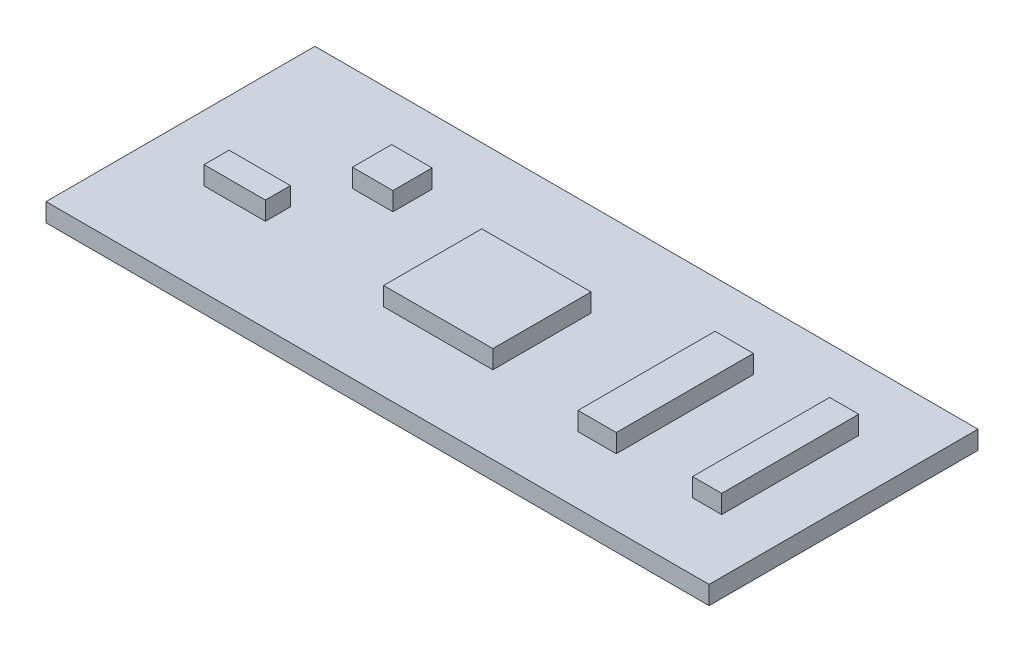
SolidWorks part; units mm, degrees
ref_plane "Front" through (0, 0, 0) normal (0, 0, 1) x (1, 0, 0)
ref_plane "Top" through (0, 0, 0) normal (0, 1, 0) x (1, 0, 0)
ref_plane "Right" through (0, 0, 0) normal (1, 0, 0) x (0, 0, -1)
sketch "Sketch1" plane through (0, 0, 0) normal (0, 0, 1) x (1, 0, 0)
  line L1 (0, 0) -> (54, 0)
  line L2 (0, 0) -> (0, 1.5)
  line L3 (0, 1.5) -> (54, 1.5)
  line L4 (54, 0) -> (54, 1.5)
  dimension "D1" = 54
  dimension "D2" = 1.5
extrude "Base-Extrude" add sketch "Sketch1" against normal blind 21.9
sketch "Sketch3" plane through (0, 1.5, 0) normal (0, 1, 0) x (-1, 0, 0)
  line L1 (-5.3284, -7.5416) -> (-10.3268, -7.5416)
  line L2 (-5.3284, -7.5416) -> (-5.3284, -9.5797)
  line L3 (-5.3284, -9.5797) -> (-10.3268, -9.5797)
  line L4 (-10.3268, -7.5416) -> (-10.3268, -9.5797)
  line L5 (-21.1644, -14.3229) -> (-30.0618, -14.3229)
  line L6 (-21.1644, -14.3229) -> (-21.1644, -6.3301)
  line L7 (-21.1644, -6.3301) -> (-30.0618, -6.3301)
  line L8 (-30.0618, -14.3229) -> (-30.0618, -6.3301)
  line L9 (-41.0082, -5.4358) -> (-37.8898, -5.4358)
  line L10 (-41.0082, -5.4358) -> (-41.0082, -16.5959)
  line L11 (-41.0082, -16.5959) -> (-37.8898, -16.5959)
  line L12 (-37.8898, -5.4358) -> (-37.8898, -16.5959)
  line L13 (-11.5517, -16.5959) -> (-14.8466, -16.5959)
  line L14 (-11.5517, -16.5959) -> (-11.5517, -13.4031)
  line L15 (-11.5517, -13.4031) -> (-14.8466, -13.4031)
  line L16 (-14.8466, -16.5959) -> (-14.8466, -13.4031)
  line L17 (-47.2218, -5.4358) -> (-49.5901, -5.4358)
  line L18 (-47.2218, -5.4358) -> (-47.2218, -16.5959)
  line L19 (-47.2218, -16.5959) -> (-49.5901, -16.5959)
  line L20 (-49.5901, -5.4358) -> (-49.5901, -16.5959)
extrude "Boss-Extrude1" add sketch "Sketch3" along normal blind 1.5
